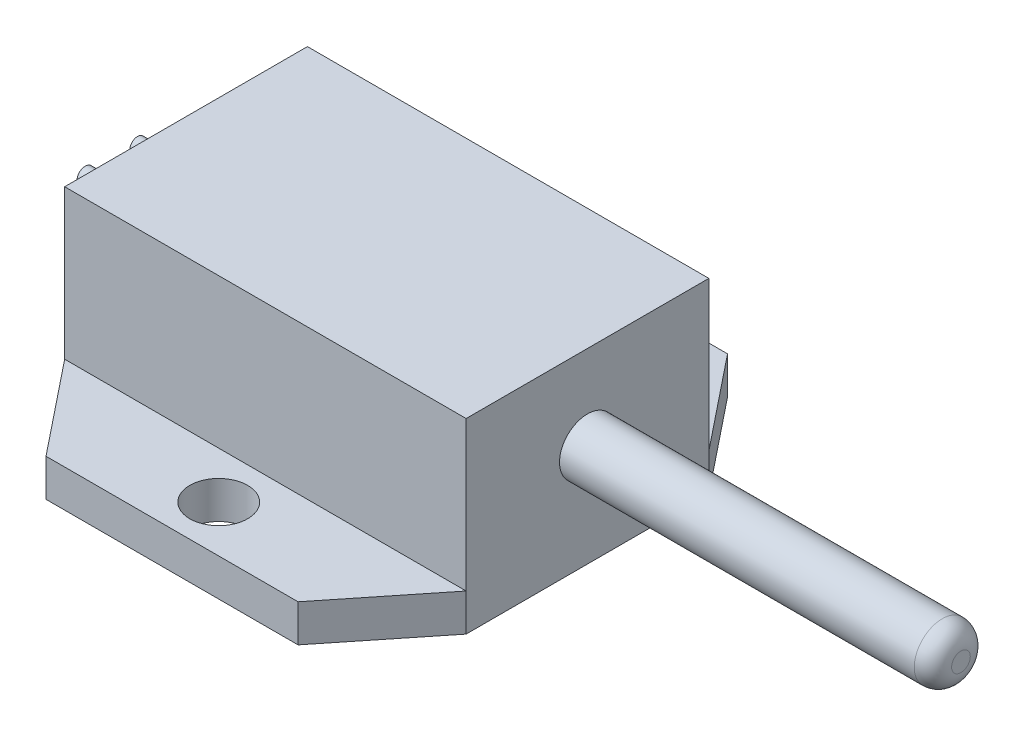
SolidWorks part; units mm, degrees
ref_plane "Front Plane" through (0, 0, 0) normal (0, 0, 1) x (1, 0, 0)
ref_plane "Top Plane" through (0, 0, 0) normal (0, 1, 0) x (1, 0, 0)
ref_plane "Right Plane" through (0, 0, 0) normal (1, 0, 0) x (0, 0, -1)
sketch "Sketch1" plane through (0, 0, 0) normal (0, 1, 0) x (1, 0, 0)
  line L0 (-10.75, 6.5) -> (-6.75, 11.5)
  line L1 (-6.75, -11.5) -> (6.75, -11.5)
  line L2 (-6.75, -11.5) -> (-6.75, 11.5)
  line L3 (-6.75, 11.5) -> (6.75, 11.5)
  line L4 (6.75, -11.5) -> (6.75, 11.5)
  line L5 (-6.75, -11.5) -> (6.75, 11.5) construction
  line L6 (-6.75, 11.5) -> (6.75, -11.5) construction
  line L7 (10.75, 6.5) -> (-10.75, 6.5)
  line L8 (10.75, 6.5) -> (10.75, -6.5)
  line L9 (10.75, -6.5) -> (-10.75, -6.5)
  line L10 (-10.75, 6.5) -> (-10.75, -6.5)
  line L11 (10.75, 6.5) -> (-10.75, -6.5) construction
  line L12 (10.75, -6.5) -> (-10.75, 6.5) construction
  line L13 (6.75, 11.5) -> (10.75, 6.5)
  line L14 (10.75, -6.5) -> (6.75, -11.5)
  line L15 (-6.75, -11.5) -> (-10.75, -6.5)
  line L16 (0, 11.5) -> (0, -11.5) construction
  line L17 (-6.2587, -6.5) -> (-6.2587, -11.5) construction
  line L18 (-5.8013, 6.5) -> (-5.8013, 11.5) construction
  circle A0 centre (0, -9) radius 1.55
  circle A1 centre (0, 9) radius 1.55
  point P0 (0, 0)
  point P6 (0, 0)
  point P14 (0, 0)
  point P18 (-6.2587, -9)
  point P19 (-5.8013, 9)
  point P22 (10.75, 6.5706)
  dimension "D3" = 3.1
  dimension "D1" = 21.5
  dimension "D2" = 13.5
  dimension "D4" = 18
  dimension "D5" = 13
extrude "Boss-Extrude1" add sketch "Sketch1" along normal blind 2 contours L15 L2 L9 | L14 L9 L4 | L9 L8 L7 L4 | L13 L4 L7 | L7 L2 L0 | L7 L10 L9 L2 | A0 | A1
sketch "Sketch2" plane through (0, 2, 0) normal (0, 1, 0) x (1, 0, 0)
  line L1 (10.75, -6.5) -> (-10.75, -6.5)
  line L2 (10.75, -6.5) -> (10.75, 6.5)
  line L3 (10.75, 6.5) -> (-10.75, 6.5)
  line L4 (-10.75, -6.5) -> (-10.75, 6.5)
  line L5 (10.75, -6.5) -> (-10.75, 6.5) construction
  line L6 (10.75, 6.5) -> (-10.75, -6.5) construction
  point P0 (0, 0)
extrude "Boss-Extrude2" add sketch "Sketch2" along normal blind 8
sketch "Sketch4" plane through (-10.75, 0, 0) normal (-1, 0, 0) x (0, 0, 1)
  line L0 (-6.5, 2) -> (6.5, 2) construction
  line L1 (0, 2) -> (0, 10) construction
  line L2 (-6.5, 10) -> (6.5, 10) construction
  line L3 (-1.5, 5.9587) -> (1.5, 5.9587) construction
  line L4 (-1.5, 6.9587) -> (1.5, 6.9587)
  line L5 (-1.5, 4.9587) -> (1.5, 4.9587)
  arc A0 (-1.5, 6.9587) -> (-1.5, 4.9587) centre (-1.5, 5.9587) ccw
  arc A1 (1.5, 4.9587) -> (1.5, 6.9587) centre (1.5, 5.9587) ccw
  point P10 (0, 5.9587)
  point P15 (0, 0)
  dimension "D1" = 3
  dimension "D2" = 2
extrude "Cut-Extrude1" cut sketch "Sketch4" against normal blind 1
sketch "Sketch5" plane through (-9.75, 0, 0) normal (-1, 0, 0) x (0, 0, 1)
  line L0 (0, 0) -> (0, 5.9673) construction
  line L1 (0, 6.9587) -> (0, 4.9759) construction
  line L2 (1.5, 6.9587) -> (-1.5, 6.9587) construction
  line L3 (-1.4, 5.9673) -> (1.4, 5.9673) construction
  circle A0 centre (-1.4, 5.9673) radius 0.4136
  circle A1 centre (1.4, 5.9673) radius 0.4377
  point P11 (0, 5.9673)
  dimension "D1" = 1.9828
  dimension "D2" = 5.9673
  dimension "D3" = 2.8
extrude "Boss-Extrude3" add sketch "Sketch5" along normal blind 5
sketch "Sketch6" plane through (10.75, 0, 0) normal (1, 0, 0) x (0, 0, -1)
  line L0 (0, 0) -> (0, 5.4649) construction
  circle A0 centre (0, 5.4649) radius 1.5
  dimension "D2" = 3
  dimension "D1" = 5.4649
extrude "Boss-Extrude4" add sketch "Sketch6" along normal blind 20
fillet "Fillet4" radius 1 1 edges at (30.75, 5.4649, -1.5)
